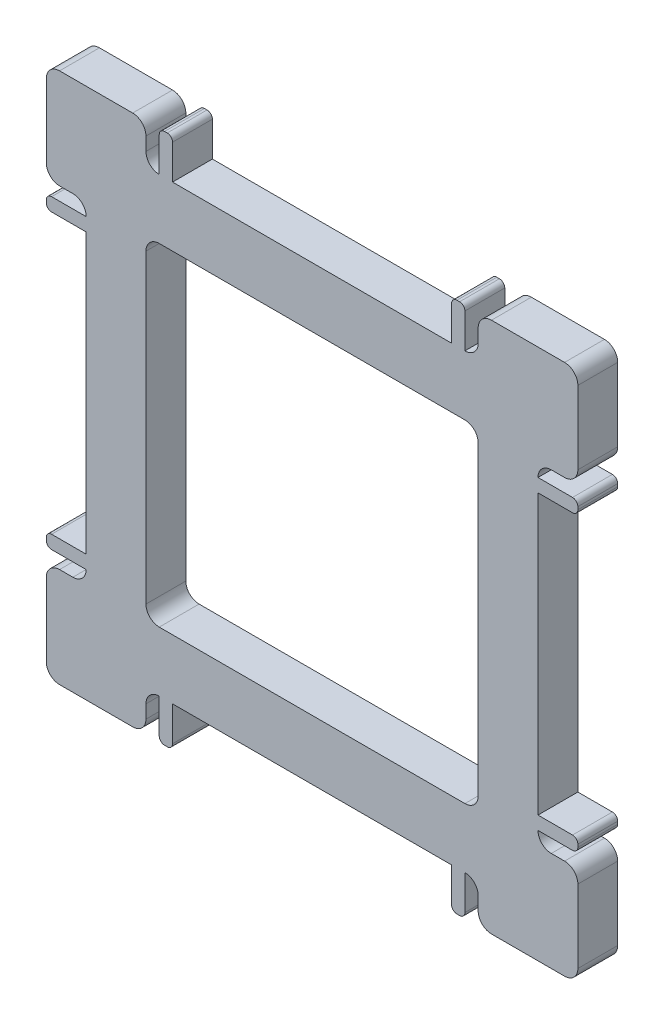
SolidWorks part; units mm, degrees
ref_plane "Front Plane" through (0, 0, 0) normal (0, 0, 1) x (1, 0, 0)
ref_plane "Top Plane" through (0, 0, 0) normal (0, 1, 0) x (1, 0, 0)
ref_plane "Right Plane" through (0, 0, 0) normal (1, 0, 0) x (0, 0, -1)
sketch "Sketch1" plane through (0, 0, 0) normal (0, 0, 1) x (1, 0, 0)
  line L0 (20, 20) -> (-20, -20) construction
  line L1 (-19, 20) -> (-13.5, 20)
  line L2 (-20, 19) -> (-20, 13.5)
  line L3 (-19, -20) -> (-13.5, -20)
  line L4 (20, 19) -> (20, 13.5)
  line L5 (0, -20) -> (0, 20) construction
  line L6 (-20, 0) -> (20, 0) construction
  line L7 (-20, 20) -> (20, -20) construction
  line L8 (19, -12.5) -> (18, -12.5)
  line L9 (-19, 12.5) -> (-18, 12.5)
  line L10 (13.5, -20) -> (19, -20)
  line L11 (-19, -12.5) -> (-18, -12.5)
  line L12 (-17, 11.5) -> (-17, -11.5)
  line L13 (17, 11.5) -> (17, -11.5)
  line L14 (19, 12.5) -> (18, 12.5)
  line L15 (12.5, 19) -> (12.5, 18)
  line L16 (11.5, 17) -> (-11.5, 17)
  line L17 (-12.5, 19) -> (-12.5, 18)
  line L18 (-12.5, -19) -> (-12.5, -18)
  line L19 (11.5, -17) -> (-11.5, -17)
  line L20 (12.5, -19) -> (12.5, -18)
  line L21 (-20, -13.5) -> (-20, -19)
  line L22 (20, -13.5) -> (20, -19)
  line L23 (13.5, 20) -> (19, 20)
  line L25 (-11.5, 12.5) -> (11.5, 12.5)
  line L26 (-12.5, 11.5) -> (-12.5, -11.5)
  line L27 (-11.5, -12.5) -> (11.5, -12.5)
  line L28 (12.5, 11.5) -> (12.5, -11.5)
  line L29 (0, -12.5) -> (0, 12.5) construction
  line L30 (-12.5, 0) -> (12.5, 0) construction
  arc A0 (-19, -20) -> (-20, -19) centre (-19, -19) cw
  arc A1 (19, -20) -> (20, -19) centre (19, -19) ccw
  arc A2 (20, 19) -> (19, 20) centre (19, 19) ccw
  arc A3 (-19, 20) -> (-20, 19) centre (-19, 19) ccw
  arc A4 (11.5, -12.5) -> (12.5, -11.5) centre (11.5, -11.5) ccw
  arc A5 (12.5, 11.5) -> (11.5, 12.5) centre (11.5, 11.5) ccw
  arc A6 (-12.5, 11.5) -> (-11.5, 12.5) centre (-11.5, 11.5) cw
  arc A7 (-12.5, -11.5) -> (-11.5, -12.5) centre (-11.5, -11.5) ccw
  arc A8 (12.5, 18) -> (11.5, 17) centre (11.5, 18) cw
  arc A9 (12.5, 19) -> (13.5, 20) centre (13.5, 19) cw
  arc A10 (19, 12.5) -> (20, 13.5) centre (19, 13.5) ccw
  arc A11 (17, 11.5) -> (18, 12.5) centre (18, 11.5) cw
  arc A12 (18, -12.5) -> (17, -11.5) centre (18, -11.5) cw
  arc A13 (20, -13.5) -> (19, -12.5) centre (19, -13.5) ccw
  arc A14 (13.5, -20) -> (12.5, -19) centre (13.5, -19) cw
  arc A15 (12.5, -18) -> (11.5, -17) centre (11.5, -18) ccw
  arc A16 (-12.5, -18) -> (-11.5, -17) centre (-11.5, -18) cw
  arc A17 (-13.5, -20) -> (-12.5, -19) centre (-13.5, -19) ccw
  arc A18 (-20, -13.5) -> (-19, -12.5) centre (-19, -13.5) cw
  arc A19 (-18, -12.5) -> (-17, -11.5) centre (-18, -11.5) ccw
  arc A20 (-19, 12.5) -> (-20, 13.5) centre (-19, 13.5) cw
  arc A21 (-17, 11.5) -> (-18, 12.5) centre (-18, 11.5) ccw
  arc A22 (-12.5, 18) -> (-11.5, 17) centre (-11.5, 18) ccw
  arc A23 (-12.5, 19) -> (-13.5, 20) centre (-13.5, 19) ccw
  point P0 (0, 0)
  point P32 (0, 0)
  point P38 (12.5, -12.5)
  point P41 (12.5, 12.5)
  point P45 (-12.5, 12.5)
  point P50 (12.5, 17)
  point P53 (12.5, 20)
  point P56 (20, 12.5)
  point P59 (17, 12.5)
  point P62 (17, -12.5)
  point P65 (20, -12.5)
  point P68 (12.5, -20)
  point P71 (12.5, -17)
  point P74 (-12.5, -17)
  point P77 (-12.5, -20)
  point P80 (-20, -12.5)
  point P83 (-17, -12.5)
  point P86 (-20, 12.5)
  point P89 (-17, 12.5)
  point P92 (-12.5, 17)
  point P95 (-12.5, 20)
  dimension "D6" = 1
  dimension "D8" = 1
  dimension "D1" = 40
  dimension "D2" = 17
  dimension "D3" = 25
  dimension "D4" = 7.5
  dimension "D5" = 3
  dimension "D7" = 25
extrude "Boss-Extrude1" add sketch "Sketch1" along normal blind 3
sketch "Sketch2" plane through (0, 0, 3) normal (0, 0, 1) x (1, 0, 0)
  line L1 (-17, 11.5) -> (-19.6, 11.5)
  line L2 (-17, 11.5) -> (-17, 10.5)
  line L3 (-17, 10.5) -> (-19.6, 10.5)
  line L4 (-20, 11.1) -> (-20, 10.9)
  line L5 (0, 20.9216) -> (0, -21.4151) construction
  line L6 (-19.7071, -19.7071) -> (19.7071, 19.7071) construction
  line L7 (-17, 0) -> (17, 0) construction
  line L8 (-17, 11.5) -> (-17, -11.5) construction
  line L9 (17, -11.5) -> (17, 11.5) construction
  line L10 (-20, -11.1) -> (-20, -10.9)
  line L11 (-17, -10.5) -> (-19.6, -10.5)
  line L12 (-17, -11.5) -> (-17, -10.5)
  line L13 (-17, -11.5) -> (-19.6, -11.5)
  line L14 (17, -11.5) -> (19.6, -11.5)
  line L15 (17, -11.5) -> (17, -10.5)
  line L16 (17, -10.5) -> (19.6, -10.5)
  line L17 (20, -11.1) -> (20, -10.9)
  line L18 (20, 11.1) -> (20, 10.9)
  line L19 (17, 10.5) -> (19.6, 10.5)
  line L20 (17, 11.5) -> (17, 10.5)
  line L21 (17, 11.5) -> (19.6, 11.5)
  line L22 (17, -11.5) -> (19.6, -11.5)
  line L23 (17, -11.5) -> (17, -10.5)
  line L24 (17, -10.5) -> (19.6, -10.5)
  line L25 (20, -11.1) -> (20, -10.9)
  line L26 (20, 11.1) -> (20, 10.9)
  line L27 (17, 10.5) -> (19.6, 10.5)
  line L28 (17, 11.5) -> (17, 10.5)
  line L29 (17, 11.5) -> (19.6, 11.5)
  line L30 (-17, 11.5) -> (-19.6, 11.5)
  line L31 (-17, 11.5) -> (-17, 10.5)
  line L32 (-17, 10.5) -> (-19.6, 10.5)
  line L33 (-20, 11.1) -> (-20, 10.9)
  line L34 (-20, -11.1) -> (-20, -10.9)
  line L35 (-17, -10.5) -> (-19.6, -10.5)
  line L36 (-17, -11.5) -> (-17, -10.5)
  line L37 (-17, -11.5) -> (-19.6, -11.5)
  line L38 (-11.5, -17) -> (-11.5, -19.6)
  line L39 (-11.5, -17) -> (-10.5, -17)
  line L40 (-10.5, -17) -> (-10.5, -19.6)
  line L41 (-11.1, -20) -> (-10.9, -20)
  line L42 (11.1, -20) -> (10.9, -20)
  line L43 (10.5, -17) -> (10.5, -19.6)
  line L44 (11.5, -17) -> (10.5, -17)
  line L45 (11.5, -17) -> (11.5, -19.6)
  line L46 (11.5, 17) -> (11.5, 19.6)
  line L47 (11.5, 17) -> (10.5, 17)
  line L48 (10.5, 17) -> (10.5, 19.6)
  line L49 (11.1, 20) -> (10.9, 20)
  line L50 (-11.1, 20) -> (-10.9, 20)
  line L51 (-10.5, 17) -> (-10.5, 19.6)
  line L52 (-11.5, 17) -> (-10.5, 17)
  line L53 (-11.5, 17) -> (-11.5, 19.6)
  line L54 (11.5, 17) -> (11.5, 19.6)
  line L55 (11.5, 17) -> (10.5, 17)
  line L56 (10.5, 17) -> (10.5, 19.6)
  line L57 (11.1, 20) -> (10.9, 20)
  line L58 (-11.1, 20) -> (-10.9, 20)
  line L59 (-10.5, 17) -> (-10.5, 19.6)
  line L60 (-11.5, 17) -> (-10.5, 17)
  line L61 (-11.5, 17) -> (-11.5, 19.6)
  line L62 (-11.5, -17) -> (-11.5, -19.6)
  line L63 (-11.5, -17) -> (-10.5, -17)
  line L64 (-10.5, -17) -> (-10.5, -19.6)
  line L65 (-11.1, -20) -> (-10.9, -20)
  line L66 (11.1, -20) -> (10.9, -20)
  line L67 (10.5, -17) -> (10.5, -19.6)
  line L68 (11.5, -17) -> (10.5, -17)
  line L69 (11.5, -17) -> (11.5, -19.6)
  arc A0 (-19.6, 10.5) -> (-20, 10.9) centre (-19.6, 10.9) cw
  arc A1 (-20, 11.1) -> (-19.6, 11.5) centre (-19.6, 11.1) cw
  arc A2 (-20, -19) -> (-19, -20) centre (-19, -19) ccw construction
  arc A3 (20, 19) -> (19, 20) centre (19, 19) ccw construction
  arc A4 (-20, -11.1) -> (-19.6, -11.5) centre (-19.6, -11.1) ccw
  arc A5 (-19.6, -10.5) -> (-20, -10.9) centre (-19.6, -10.9) ccw
  arc A6 (19.6, -10.5) -> (20, -10.9) centre (19.6, -10.9) cw
  arc A7 (20, -11.1) -> (19.6, -11.5) centre (19.6, -11.1) cw
  arc A8 (20, 11.1) -> (19.6, 11.5) centre (19.6, 11.1) ccw
  arc A9 (19.6, 10.5) -> (20, 10.9) centre (19.6, 10.9) ccw
  arc A10 (19.6, -10.5) -> (20, -10.9) centre (19.6, -10.9) cw
  arc A11 (20, -11.1) -> (19.6, -11.5) centre (19.6, -11.1) cw
  arc A12 (20, 11.1) -> (19.6, 11.5) centre (19.6, 11.1) ccw
  arc A13 (19.6, 10.5) -> (20, 10.9) centre (19.6, 10.9) ccw
  arc A14 (-19.6, 10.5) -> (-20, 10.9) centre (-19.6, 10.9) cw
  arc A15 (-20, 11.1) -> (-19.6, 11.5) centre (-19.6, 11.1) cw
  arc A16 (-20, -11.1) -> (-19.6, -11.5) centre (-19.6, -11.1) ccw
  arc A17 (-19.6, -10.5) -> (-20, -10.9) centre (-19.6, -10.9) ccw
  arc A18 (-10.5, -19.6) -> (-10.9, -20) centre (-10.9, -19.6) cw
  arc A19 (-11.1, -20) -> (-11.5, -19.6) centre (-11.1, -19.6) cw
  arc A20 (11.1, -20) -> (11.5, -19.6) centre (11.1, -19.6) ccw
  arc A21 (10.5, -19.6) -> (10.9, -20) centre (10.9, -19.6) ccw
  arc A22 (10.5, 19.6) -> (10.9, 20) centre (10.9, 19.6) cw
  arc A23 (11.1, 20) -> (11.5, 19.6) centre (11.1, 19.6) cw
  arc A24 (-11.1, 20) -> (-11.5, 19.6) centre (-11.1, 19.6) ccw
  arc A25 (-10.5, 19.6) -> (-10.9, 20) centre (-10.9, 19.6) ccw
  arc A26 (10.5, 19.6) -> (10.9, 20) centre (10.9, 19.6) cw
  arc A27 (11.1, 20) -> (11.5, 19.6) centre (11.1, 19.6) cw
  arc A28 (-11.1, 20) -> (-11.5, 19.6) centre (-11.1, 19.6) ccw
  arc A29 (-10.5, 19.6) -> (-10.9, 20) centre (-10.9, 19.6) ccw
  arc A30 (-10.5, -19.6) -> (-10.9, -20) centre (-10.9, -19.6) cw
  arc A31 (-11.1, -20) -> (-11.5, -19.6) centre (-11.1, -19.6) cw
  arc A32 (11.1, -20) -> (11.5, -19.6) centre (11.1, -19.6) ccw
  arc A33 (10.5, -19.6) -> (10.9, -20) centre (10.9, -19.6) ccw
  point P9 (-20, 11.5)
  point P35 (-20, -11.5)
  point P52 (20, -11.5)
  point P53 (20, 11.5)
  point P86 (11.5, 20)
  point P87 (-11.5, 20)
  point P88 (-11.5, -20)
  point P89 (11.5, -20)
  dimension "D3" = 0.4
  dimension "D1" = 3
  dimension "D2" = 1
extrude "Boss-Extrude2" add sketch "Sketch2" against normal blind 3 contours L51 A25 L50 A24 L53 M31 | A23 L49 A22 L48 L46 M31 | L19 A9 L18 A8 L21 M21 | A7 L17 A6 L16 L14 M21 | L43 A21 L42 A20 L45 M11 | A19 L41 A18 L40 L38 M11 | L11 A5 L10 A4 L13 M41 | A1 L4 A0 L3 L1 M41
